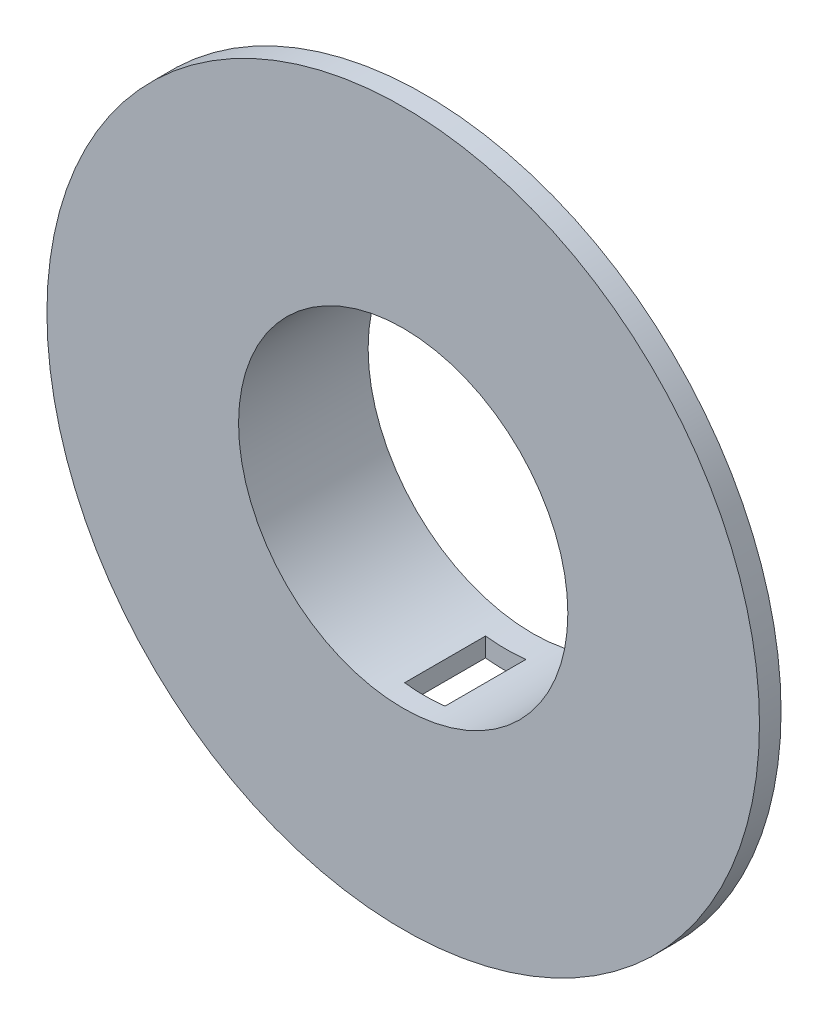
SolidWorks part; units mm, degrees
ref_plane "正面" through (0, 0, 0) normal (0, 0, 1) x (1, 0, 0)
ref_plane "平面" through (0, 0, 0) normal (0, 1, 0) x (1, 0, 0)
ref_plane "右側面" through (0, 0, 0) normal (1, 0, 0) x (0, 0, -1)
sketch "ｽｹｯﾁ4" plane through (0, 0, 0) normal (0, 0, 1) x (1, 0, 0)
  circle A0 centre (0, 0) radius 66
extrude "ﾎﾞｽ - 押し出し2" add sketch "ｽｹｯﾁ4" along normal blind 4
sketch "ｽｹｯﾁ5" plane through (0, 0, 4) normal (0, 0, 1) x (1, 0, 0)
  circle A0 centre (0, 0) radius 30.5
  dimension "D1" = 61
extrude "ｶｯﾄ - 押し出し1" cut sketch "ｽｹｯﾁ5" against normal blind 30
ref_plane "平面3" through (0, 0, 0) normal (0, 1, 0) x (1, 0, 0)
sketch "ｽｹｯﾁ6" plane through (0, 0, 0) normal (0, 0, -1) x (-1, 0, 0)
  circle A0 centre (0, 0) radius 34
  dimension "D1" = 68
extrude "ﾎﾞｽ - 押し出し3" add sketch "ｽｹｯﾁ6" along normal blind 20
sketch "ｽｹｯﾁ7" plane through (0, 0, -20) normal (0, 0, -1) x (-1, 0, 0)
  circle A0 centre (0, 0) radius 30.5
extrude "ｶｯﾄ - 押し出し2" cut sketch "ｽｹｯﾁ7" against normal through all
sketch "ｽｹｯﾁ8" plane through (0, 0, 0) normal (0, 1, 0) x (1, 0, 0)
  line L0 (66, 0) -> (-66, 0) construction
  line L1 (3.75, 15) -> (-3.75, 15)
  line L2 (3.75, 15) -> (3.75, 0)
  line L3 (3.75, 0) -> (-3.75, 0)
  line L4 (-3.75, 15) -> (-3.75, 0)
  line L5 (0, 0) -> (0, 15) construction
  line L6 (3.75, 7.5) -> (-3.75, 7.5) construction
  point P0 (0, 7.5)
  dimension "D1" = 7.5
  dimension "D2" = 15
  dimension "D3" = 7.5
extrude "ｶｯﾄ - 押し出し3" cut sketch "ｽｹｯﾁ8" against normal through all and the other way through all
